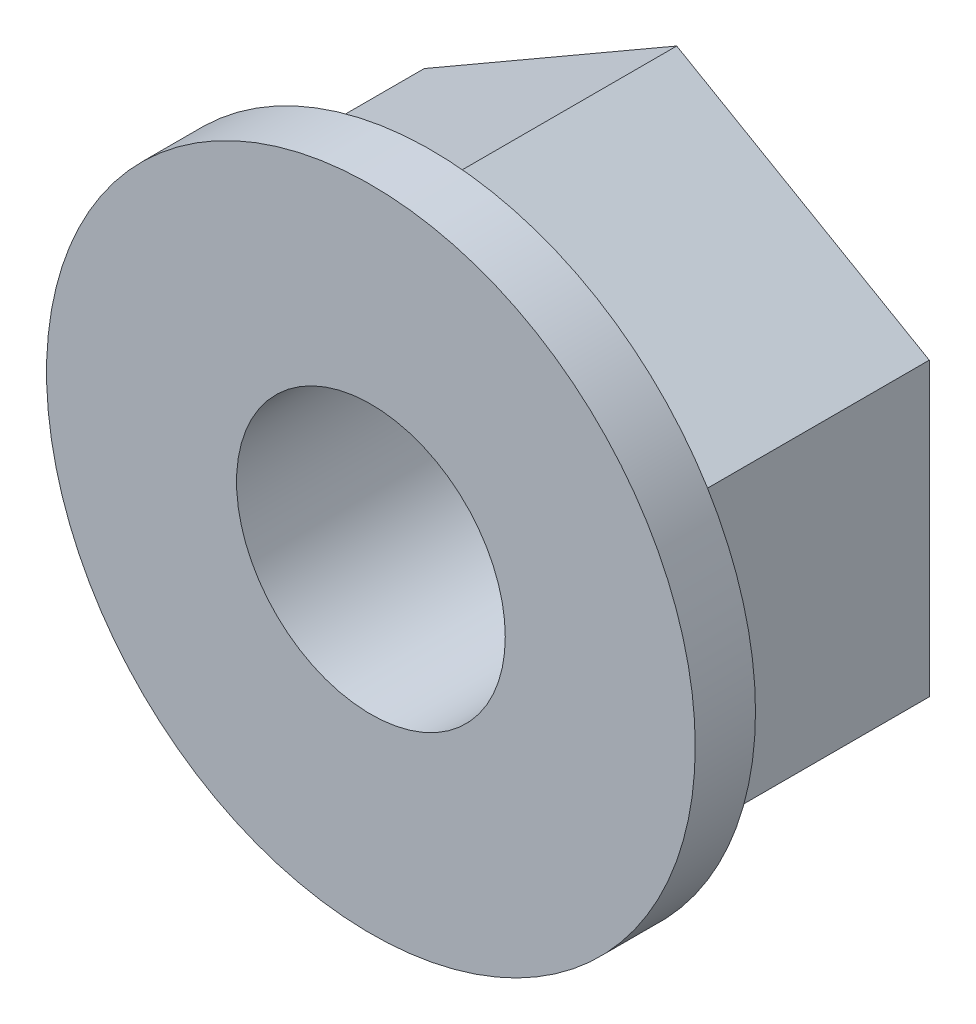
SolidWorks part; units mm, degrees
ref_plane "Plan de face" through (0, 0, 0) normal (0, 0, 1) x (1, 0, 0)
ref_plane "Plan de dessus" through (0, 0, 0) normal (0, 1, 0) x (1, 0, 0)
ref_plane "Plan de droite" through (0, 0, 0) normal (1, 0, 0) x (0, 0, -1)
sketch "Esquisse1" plane through (0, 0, 0) normal (0, 0, 1) x (1, 0, 0)
  line L1 (0, 3.1466) -> (-2.725, 1.5733)
  line L2 (-2.725, 1.5733) -> (-2.725, -1.5733)
  line L3 (-2.725, -1.5733) -> (0, -3.1466)
  line L4 (0, -3.1466) -> (2.725, -1.5733)
  line L5 (2.725, -1.5733) -> (2.725, 1.5733)
  line L6 (2.725, 1.5733) -> (0, 3.1466)
  circle A0 centre (0, 0) radius 2.725 construction
  circle A1 centre (0, 0) radius 1.45
extrude "Extrusion1" add sketch "Esquisse1" along normal blind 2.65
sketch "Esquisse2" plane through (0, 0, 2.65) normal (0, 0, 1) x (1, 0, 0)
  circle A0 centre (0, 0) radius 1.45
  circle A1 centre (0, 0) radius 3.5
extrude "Extrusion2" add sketch "Esquisse2" along normal blind 0.65
